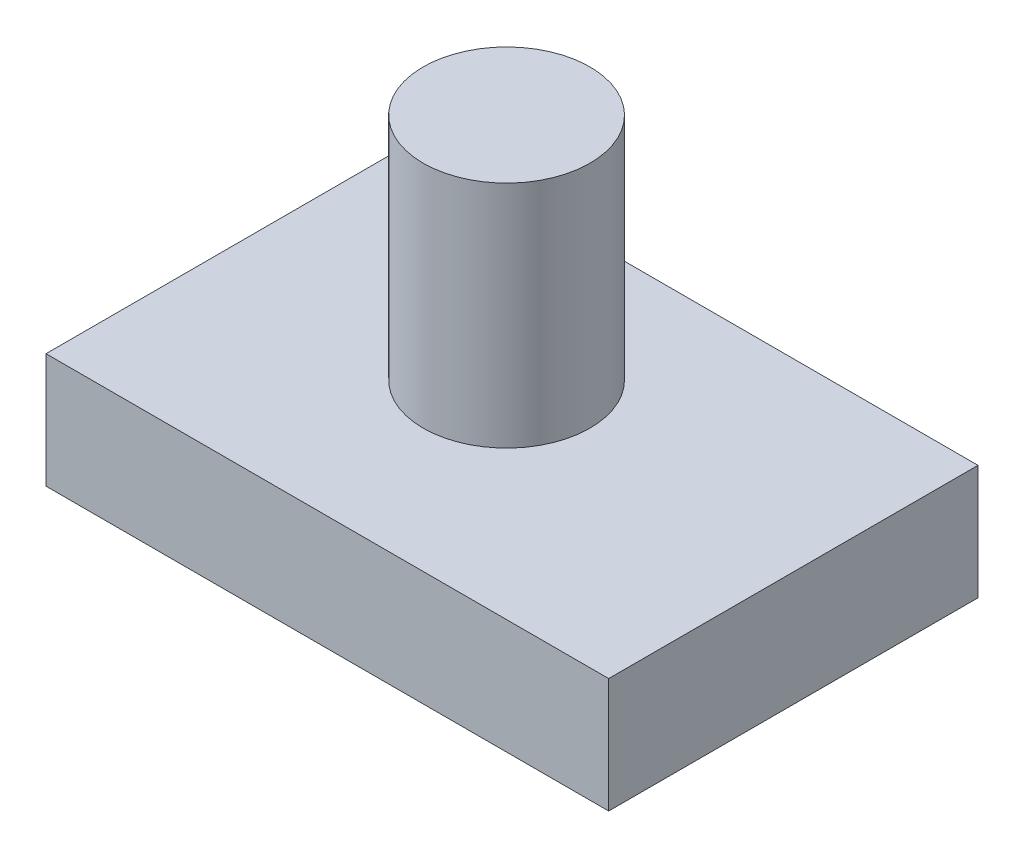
SolidWorks part; units mm, degrees
ref_plane "Front Plane" through (0, 0, 0) normal (0, 0, 1) x (1, 0, 0)
ref_plane "Top Plane" through (0, 0, 0) normal (0, 1, 0) x (1, 0, 0)
ref_plane "Right Plane" through (0, 0, 0) normal (1, 0, 0) x (0, 0, -1)
sketch "Sketch1"
extrude "Extrude1" add sketch "Sketch1" along normal blind 25.4
sketch "Sketch2"
extrude "Extrude2" add sketch "Sketch2" along normal blind 50.8
